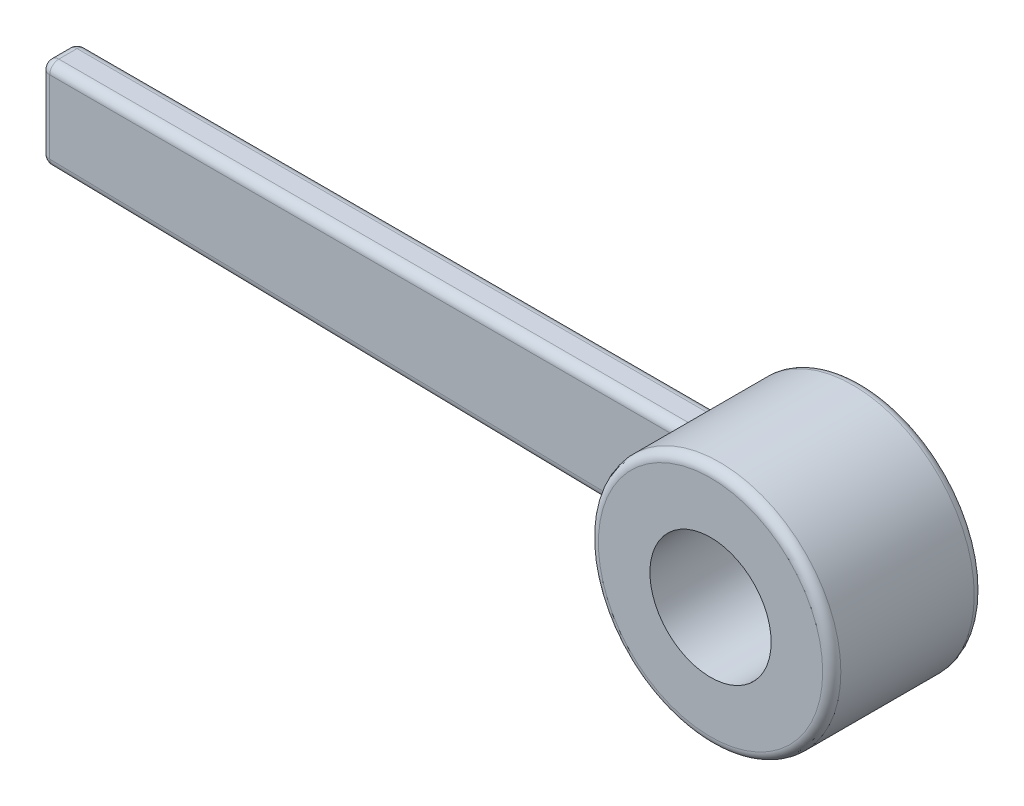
SolidWorks part; units mm, degrees
ref_plane "Plane1" through (0, 0, 0) normal (0, 0, 1) x (1, 0, 0)
ref_plane "Plane2" through (0, 0, 0) normal (0, 1, 0) x (1, 0, 0)
ref_plane "Plane3" through (0, 0, 0) normal (1, 0, 0) x (0, 0, -1)
sketch "Esquisse1" plane through (0, 0, 0) normal (0, 0, 1) x (1, 0, 0)
  circle A0 centre (0, 0) radius 40
  dimension "D1" = 80
extrude "Base-Extrusion" add sketch "Esquisse1" along normal mid plane 50
ref_plane "Plan4" through (0, 0, -10) normal (0, 0, -1) x (-1, 0, 0)
sketch "Esquisse2" plane through (0, 0, -10) normal (0, 0, -1) x (-1, 0, 0)
  line L1 (36.1403, 17.1429) -> (250, 17.1429)
  line L2 (36.1403, -17.1429) -> (250, -12.8571)
  line L3 (250, 17.1429) -> (250, -12.8571)
  circle A0 centre (0, 0) radius 40 construction
  arc A1 (36.1403, -17.1429) -> (36.1403, 17.1429) centre (0, 0) ccw
  dimension "D1" = 30
  dimension "D2" = 250
extrude "Boss.-Extru.1" add sketch "Esquisse2" along normal mid plane 12
sketch "Esquisse3" plane through (0, 0, 25) normal (0, 0, 1) x (1, 0, 0)
  circle A0 centre (0, 0) radius 20
  dimension "D1" = 40
extrude "Enlèv. mat.-Extru.1" cut sketch "Esquisse3" against normal through all
fillet "Congé1" radius 3 14 edges at (40, 0, -25) (40, 0, 25) (-40, 0, -16) (-36.1403, 17.1429, -10) (-143.0702, -15, -4) (-36.1403, -17.1429, -10) (-250, 2.1429, -16) (-250, -12.8571, -10) (-143.0702, 17.1429, -16) (-250, 17.1429, -10) (-143.0702, -15, -16) (-40, 0, -4) (-143.0702, 17.1429, -4) (-250, 2.1429, -4)
